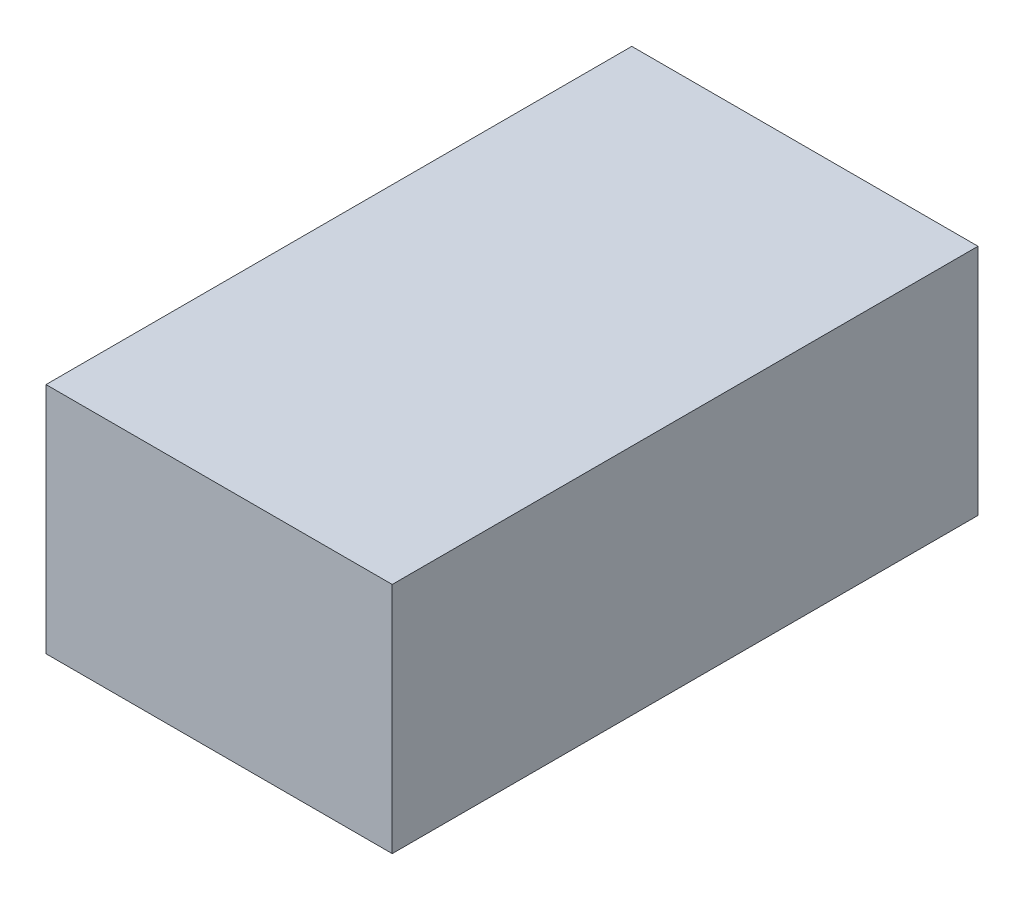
SolidWorks part; units mm, degrees
ref_plane "Ebene1" through (0, 0, 0) normal (0, 0, 1) x (1, 0, 0)
ref_plane "Ebene2" through (0, 0, 0) normal (0, 1, 0) x (1, 0, 0)
ref_plane "Ebene3" through (0, 0, 0) normal (1, 0, 0) x (0, 0, -1)
sketch "Skizze1" plane through (0, 0, 0) normal (0, 0, 1) x (1, 0, 0)
  line L1 (-59.1037, 39.7987) -> (59.1037, 39.7987)
  line L2 (-59.1037, 39.7987) -> (-59.1037, -39.7987)
  line L3 (-59.1037, -39.7987) -> (59.1037, -39.7987)
  line L4 (59.1037, 39.7987) -> (59.1037, -39.7987)
  line L5 (-59.1037, 39.7987) -> (59.1037, -39.7987) construction
  line L6 (-59.1037, -39.7987) -> (59.1037, 39.7987) construction
  point P0 (0, 0)
extrude "Linear austragen1" add sketch "Skizze1" along normal mid plane 200
